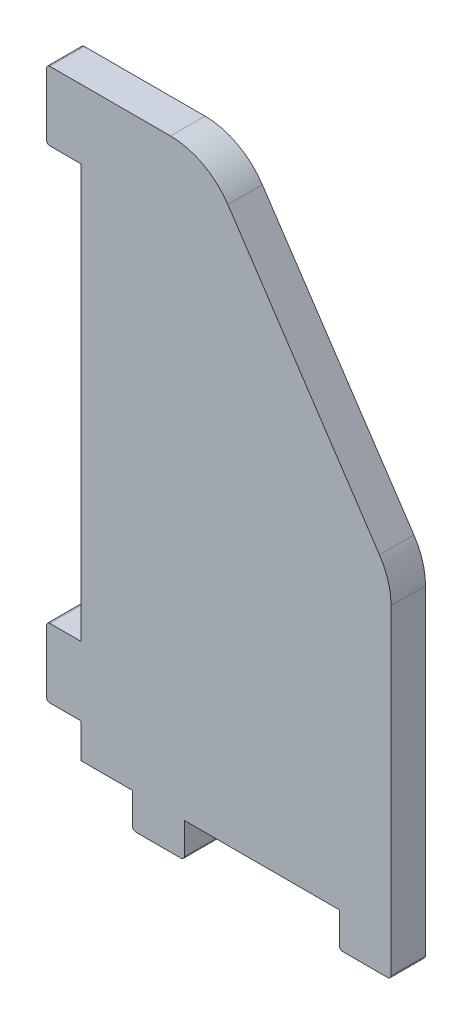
SolidWorks part; units mm, degrees
ref_plane "Front Plane" through (0, 0, 0) normal (0, 0, 1) x (1, 0, 0)
ref_plane "Top Plane" through (0, 0, 0) normal (0, 1, 0) x (1, 0, 0)
ref_plane "Right Plane" through (0, 0, 0) normal (1, 0, 0) x (0, 0, -1)
sketch "Sketch1" plane through (0, 0, 0) normal (0, 0, 1) x (1, 0, 0)
  line L0 (0, 0) -> (30, 0)
  line L1 (60, 0) -> (150, 0)
  line L2 (0, 0) -> (0, 20)
  line L3 (0, 20) -> (-20, 20)
  line L4 (-20, 20) -> (-20, 60)
  line L5 (-20, 60) -> (0, 60)
  line L6 (0, 60) -> (0, 300)
  line L7 (0, 300) -> (-20, 300)
  line L8 (-20, 300) -> (-20, 340)
  line L9 (-20, 340) -> (0, 340)
  line L10 (0, 340) -> (73.3836, 340)
  line L11 (150, -20) -> (150, 0)
  line L12 (30, -20) -> (60, -20)
  line L13 (60, -20) -> (60, 0)
  line L14 (180, 0) -> (180, -20)
  line L15 (180, -20) -> (150, -20)
  line L16 (30, -20) -> (30, 0)
  line L17 (180, 0) -> (180, 180)
  line L18 (180, 180) -> (73.3836, 340)
  dimension "D1" = 30
  dimension "D2" = 73.3836
  dimension "D3" = 150
  dimension "D4" = 20
  dimension "D5" = 60
  dimension "D6" = 180
  dimension "D7" = 300
extrude "Boss-Extrude1" add sketch "Sketch1" along normal blind 20
fillet "Fillet2" radius 40 2 edges at (73.3836, 340, 10) (180, 180, 10)
fillet "Fillet3" radius 2 8 edges at (60, -20, 10) (180, -20, 10) (150, -20, 10) (30, -20, 10) (-20, 300, 10) (-20, 340, 10) (-20, 60, 10) (-20, 20, 10)
